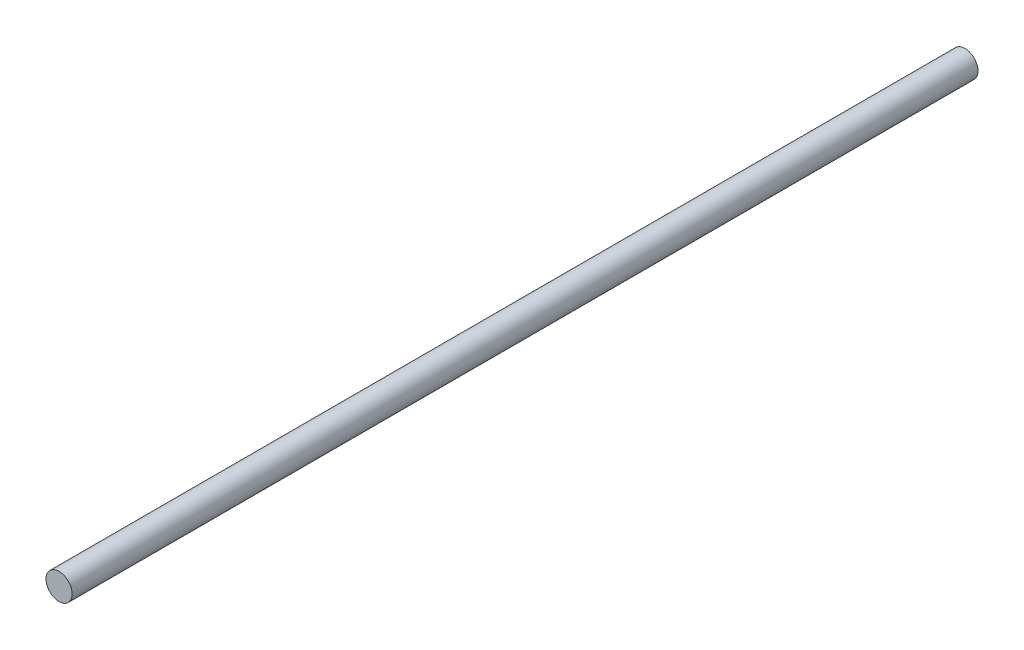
SolidWorks part; units mm, degrees
ref_plane "Спереди" through (0, 0, 0) normal (0, 0, 1) x (1, 0, 0)
ref_plane "Сверху" through (0, 0, 0) normal (0, 1, 0) x (1, 0, 0)
ref_plane "Справа" through (0, 0, 0) normal (1, 0, 0) x (0, 0, -1)
sketch "Эскиз1" plane through (0, 0, 0) normal (0, 0, 1) x (1, 0, 0)
  circle A0 centre (0, 0) radius 3.175
  dimension "D1" = 6.35
extrude "Бобышка-Вытянуть1" add sketch "Эскиз1" along normal blind 220
